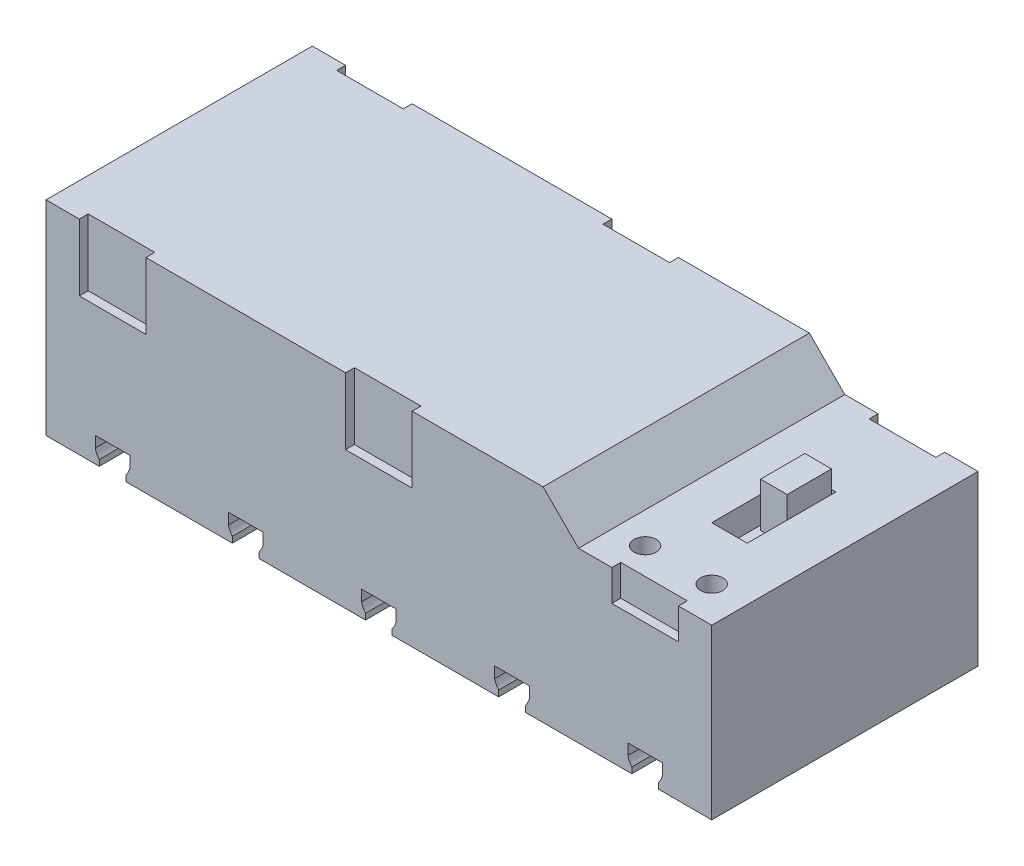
SolidWorks part; units mm, degrees
ref_plane "前视基准面" through (0, 0, 0) normal (0, 0, 1) x (1, 0, 0)
ref_plane "上视基准面" through (0, 0, 0) normal (0, 1, 0) x (1, 0, 0)
ref_plane "右视基准面" through (0, 0, 0) normal (1, 0, 0) x (0, 0, -1)
sketch "草图1" plane through (0, 0, 0) normal (0, 1, 0) x (1, 0, 0)
  line L1 (0, -15) -> (75, -15)
  line L2 (0, -15) -> (0, 15)
  line L3 (0, 15) -> (75, 15)
  line L4 (75, -15) -> (75, 15)
extrude "凸台-拉伸1" add sketch "草图1" along normal blind 23
sketch "草图2" plane through (0, 0, 15) normal (0, 0, 1) x (1, 0, 0)
  line L1 (75, 23) -> (60, 23)
  line L2 (75, 23) -> (75, 19)
  line L3 (75, 19) -> (60, 19)
  line L4 (60, 23) -> (60, 19)
extrude "切除-拉伸1" cut sketch "草图2" against normal through all
chamfer "倒角1" distance 4 angle 45 1 edges at (60, 23, 0)
sketch "草图3" plane through (0, 0, 15) normal (0, 0, 1) x (1, 0, 0)
  line L0 (50.55, 2.8) -> (54.45, 2.8)
  line L2 (0, 0) -> (75, 0) construction
  line L3 (36, 0) -> (39, 0)
  line L4 (36, 0) -> (36, 0.6771)
  line L5 (35.55, 2.8) -> (39.45, 2.8)
  line L6 (39, 0) -> (39, 0.6771)
  line L7 (39.45, 2.8) -> (39.45, 1.5556)
  line L8 (35.55, 2.8) -> (35.55, 1.5556)
  line L9 (51, 0) -> (51, 0.6771)
  line L10 (50.55, 2.8) -> (50.55, 1.5556)
  line L11 (51, 0) -> (54, 0)
  line L12 (54, 0) -> (54, 0.6771)
  line L13 (54.45, 2.8) -> (54.45, 1.5556)
  line L14 (65.55, 2.8) -> (69.45, 2.8)
  line L15 (66, 0) -> (66, 0.6771)
  line L16 (65.55, 2.8) -> (65.55, 1.5556)
  line L17 (66, 0) -> (69, 0)
  line L18 (69, 0) -> (69, 0.6771)
  line L19 (69.45, 2.8) -> (69.45, 1.5556)
  line L20 (21, 0) -> (21, 0.6771)
  line L21 (24, 0) -> (24, 0.6771)
  line L22 (21, 0) -> (24, 0)
  line L23 (20.55, 2.8) -> (20.55, 1.5556)
  line L24 (20.55, 2.8) -> (24.45, 2.8)
  line L25 (24.45, 2.8) -> (24.45, 1.5556)
  line L26 (6, 0) -> (6, 0.6771)
  line L27 (9, 0) -> (9, 0.6771)
  line L28 (6, 0) -> (9, 0)
  line L29 (5.55, 2.8) -> (5.55, 1.5556)
  line L30 (5.55, 2.8) -> (9.45, 2.8)
  line L31 (9.45, 2.8) -> (9.45, 1.5556)
  arc A0 (39, 0.6771) -> (39.45, 1.5556) centre (37.5, 2) ccw
  arc A1 (35.55, 1.5556) -> (36, 0.6771) centre (37.5, 2) ccw
  arc A2 (50.55, 1.5556) -> (51, 0.6771) centre (52.5, 2) ccw
  arc A3 (54, 0.6771) -> (54.45, 1.5556) centre (52.5, 2) ccw
  arc A4 (65.55, 1.5556) -> (66, 0.6771) centre (67.5, 2) ccw
  arc A5 (69, 0.6771) -> (69.45, 1.5556) centre (67.5, 2) ccw
  arc A6 (24, 0.6771) -> (24.45, 1.5556) centre (22.5, 2) ccw
  arc A7 (20.55, 1.5556) -> (21, 0.6771) centre (22.5, 2) ccw
  arc A8 (9, 0.6771) -> (9.45, 1.5556) centre (7.5, 2) ccw
  arc A9 (5.55, 1.5556) -> (6, 0.6771) centre (7.5, 2) ccw
extrude "切除-拉伸2" cut sketch "草图3" against normal through all
sketch "草图4" plane through (0, 23, 0) normal (0, 1, 0) x (1, 0, 0)
  line L0 (0, -15) -> (56, -15) construction
  line L1 (33.75, -15) -> (41.25, -15)
  line L2 (33.75, -15) -> (33.75, -14)
  line L3 (33.75, -14) -> (41.25, -14)
  line L4 (41.25, -15) -> (41.25, -14)
  line L5 (3.75, -14) -> (11.25, -14)
  line L6 (3.75, -15) -> (3.75, -14)
  line L7 (11.25, -15) -> (11.25, -14)
  line L8 (3.75, -15) -> (11.25, -15)
  line L9 (63.75, -14) -> (71.25, -14)
  line L10 (63.75, -15) -> (63.75, -14)
  line L11 (71.25, -15) -> (71.25, -14)
  line L12 (63.75, -15) -> (71.25, -15)
  line L13 (-1.5049, 0) -> (76.6567, 0) construction
  line L14 (63.75, 15) -> (71.25, 15)
  line L15 (71.25, 15) -> (71.25, 14)
  line L16 (63.75, 15) -> (63.75, 14)
  line L17 (63.75, 14) -> (71.25, 14)
  line L18 (3.75, 15) -> (11.25, 15)
  line L19 (11.25, 15) -> (11.25, 14)
  line L20 (3.75, 15) -> (3.75, 14)
  line L21 (3.75, 14) -> (11.25, 14)
  line L22 (41.25, 15) -> (41.25, 14)
  line L23 (33.75, 14) -> (41.25, 14)
  line L24 (33.75, 15) -> (33.75, 14)
  line L25 (33.75, 15) -> (41.25, 15)
extrude "切除-拉伸3" cut sketch "草图4" against normal blind 7.5
sketch "草图5" plane through (0, 19, 0) normal (0, 1, 0) x (1, 0, 0)
  circle A0 centre (71, -11) radius 1.25
  circle A1 centre (63.5, -11) radius 1.25
extrude "切除-拉伸4" cut sketch "草图5" against normal blind 3
sketch "草图6" plane through (0, 19, 0) normal (0, 1, 0) x (1, 0, 0)
  line L1 (65, 5) -> (69, 5)
  line L2 (65, 5) -> (65, -5)
  line L3 (65, -5) -> (69, -5)
  line L4 (69, 5) -> (69, -5)
extrude "切除-拉伸5" cut sketch "草图6" against normal blind 3
sketch "草图7" plane through (0, 16, 0) normal (0, 1, 0) x (1, 0, 0)
  line L0 (69, 5) -> (65, 5) construction
  line L1 (65.5, 5) -> (68.5, 5)
  line L2 (65.5, 5) -> (65.5, 0)
  line L3 (65.5, 0) -> (68.5, 0)
  line L4 (68.5, 5) -> (68.5, 0)
extrude "凸台-拉伸2" add sketch "草图7" along normal blind 5
